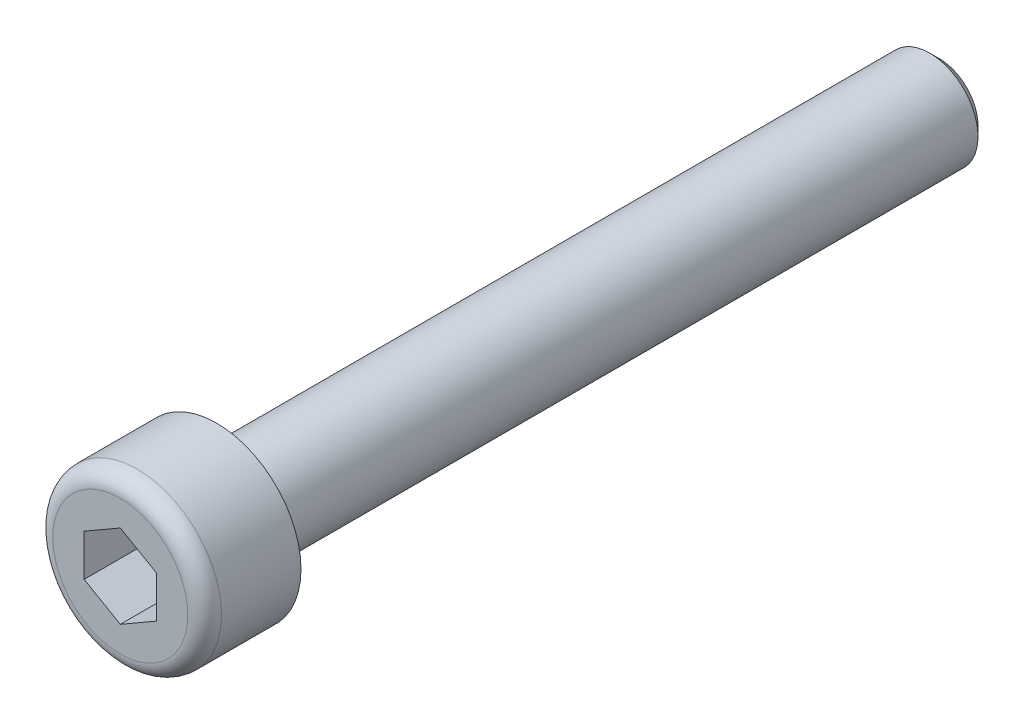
SolidWorks part; units mm, degrees
ref_plane "Face" through (0, 0, 0) normal (0, 0, 1) x (1, 0, 0)
ref_plane "Dessus" through (0, 0, 0) normal (0, 1, 0) x (1, 0, 0)
ref_plane "Droite" through (0, 0, 0) normal (1, 0, 0) x (0, 0, -1)
sketch "Esquisse1" plane through (0, 0, 0) normal (0, 0, 1) x (1, 0, 0)
  circle A0 centre (0, 0) radius 2
  dimension "D1" = 4
extrude "Base-Extrusion" add sketch "Esquisse1" along normal blind 30
sketch "Esquisse2" plane through (0, 0, 30) normal (0, 0, 1) x (1, 0, 0)
  circle A0 centre (0, 0) radius 3.5
  dimension "D1" = 7
extrude "Boss.-Extru.1" add sketch "Esquisse2" along normal blind 4
chamfer "Chanfrein1" distance 0.4 angle 45 1 edges at (2, 0, 0)
fillet "Congé1" radius 0.7 1 edges at (3.5, 0, 34)
sketch "Esquisse3" plane through (0, 0, 34) normal (0, 0, 1) x (1, 0, 0)
  line L1 (0, 1.7321) -> (-1.5, 0.866)
  line L2 (-1.5, 0.866) -> (-1.5, -0.866)
  line L3 (-1.5, -0.866) -> (0, -1.7321)
  line L4 (0, -1.7321) -> (1.5, -0.866)
  line L5 (1.5, -0.866) -> (1.5, 0.866)
  line L6 (1.5, 0.866) -> (0, 1.7321)
  circle A0 centre (0, 0) radius 1.5 construction
  dimension "D1" = 3
extrude "Enlèv. mat.-Extru.1" cut sketch "Esquisse3" against normal blind 2.5
